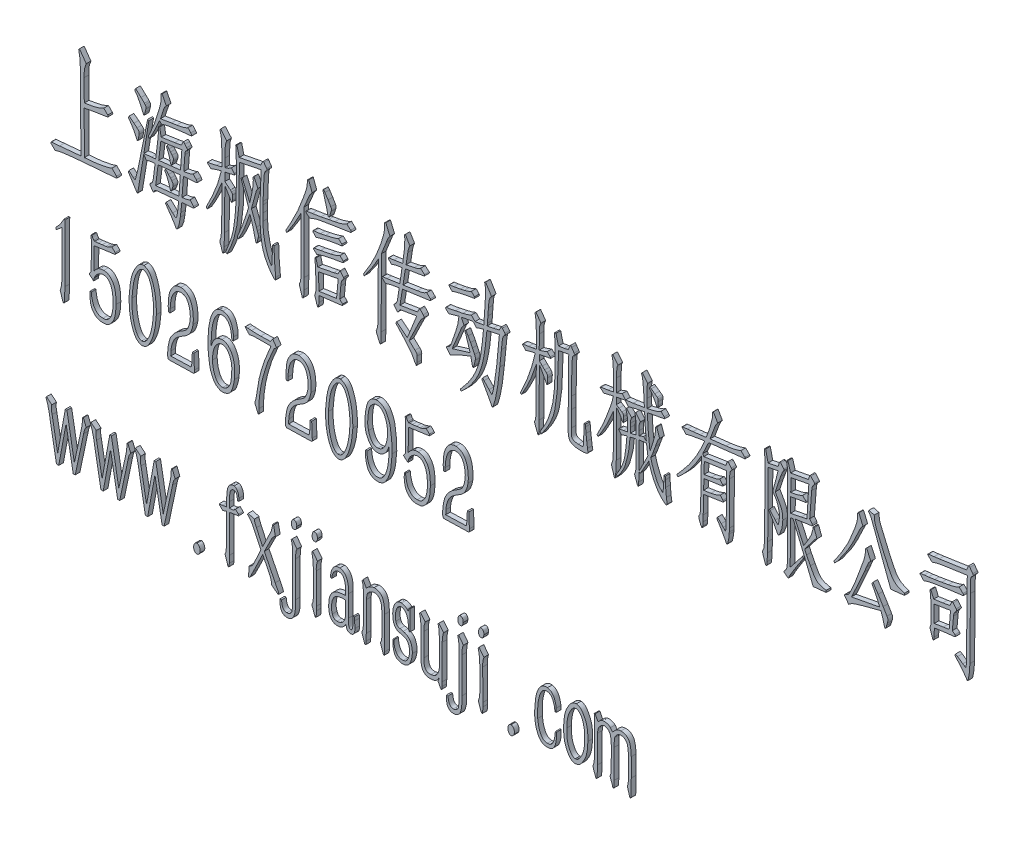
SolidWorks part; units mm, degrees
ref_plane "前视基准面" through (0, 0, 0) normal (0, 0, 1) x (1, 0, 0)
ref_plane "上视基准面" through (0, 0, 0) normal (0, 1, 0) x (1, 0, 0)
ref_plane "右视基准面" through (0, 0, 0) normal (1, 0, 0) x (0, 0, -1)
sketch "草图1" plane through (0, 0, 0) normal (0, 0, 1) x (1, 0, 0)
  text T0 "上海枫信传动机械有限公司  15026720952  www.fxjiansuji.com" font "汉仪长仿宋体" height in points 15
extrude "凸台-拉伸1" add sketch "草图1" along normal blind 0.2
